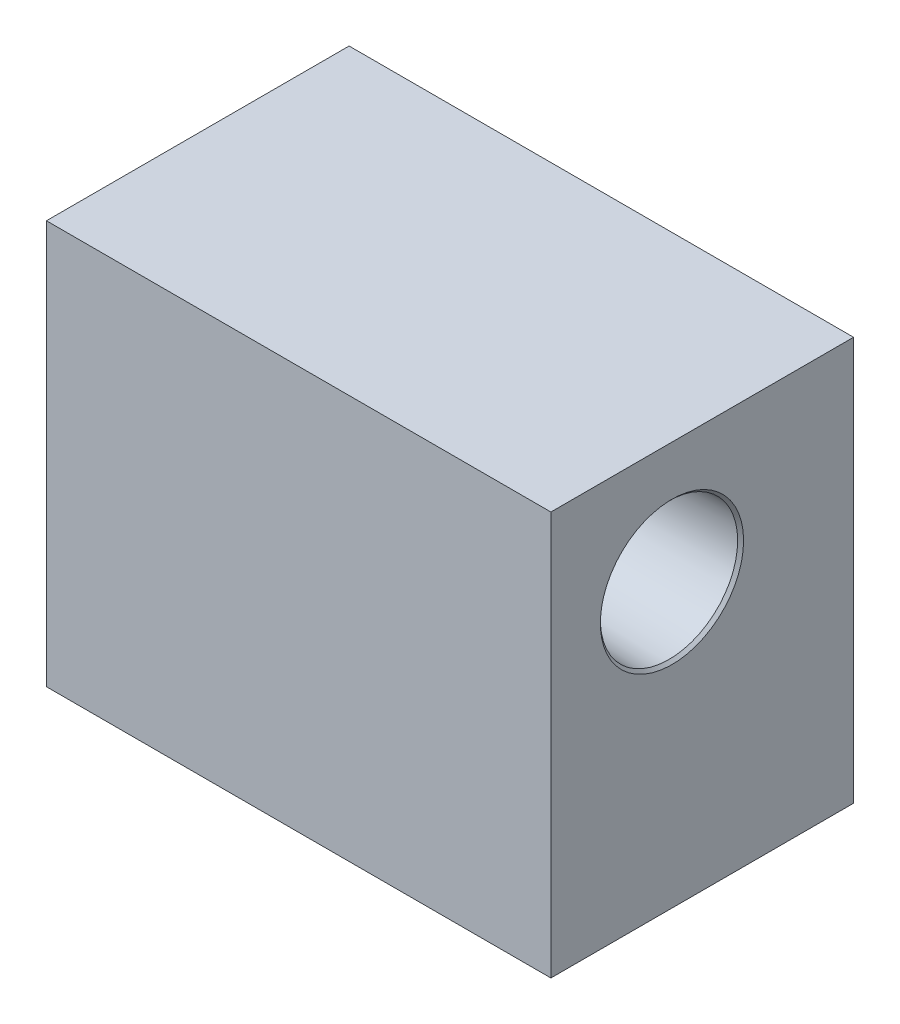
SolidWorks part; units mm, degrees
ref_plane "Front Plane" through (0, 0, 0) normal (0, 0, 1) x (1, 0, 0)
ref_plane "Top Plane" through (0, 0, 0) normal (0, 1, 0) x (1, 0, 0)
ref_plane "Right Plane" through (0, 0, 0) normal (1, 0, 0) x (0, 0, -1)
sketch "Sketch1" plane through (0, 0, 0) normal (0, 0, 1) x (1, 0, 0)
  line L1 (0, 0) -> (63.5, 0)
  line L2 (0, 0) -> (0, 50.8)
  line L3 (0, 50.8) -> (63.5, 50.8)
  line L4 (63.5, 0) -> (63.5, 50.8)
  dimension "D1" = 63.5
  dimension "D2" = 50.8
extrude "Boss-Extrude1" add sketch "Sketch1" along normal blind 38.1 contours L3 L4 L1 L2
hole_wizard "3/4 NPT Tapped Hole1" positions "Sketch3" profile "Sketch2" size "3/4" standard "ANSI Inch"
sketch "Sketch3" plane through (0, 0, 0) normal (0, -1, 0) x (-1, 0, 0)
  line L1 (0, -19.05) -> (-31.75, -19.05) construction
  line L2 (0, -38.1) -> (0, 0) construction
  line L4 (-31.75, -38.1) -> (-31.75, -19.05) construction
  line L5 (0, -38.1) -> (-63.5, -38.1) construction
  point P0 (-31.75, -19.05)
sketch "Sketch2" plane through (31.75, 0, 19.05) normal (1, 0, 0) x (0, 0, -1)
  line L0 (0, 0) -> (0, 45.0136)
  line L1 (11.5062, 38.1) -> (0, 45.0136)
  line L2 (-11.5062, 38.1) -> (0, 45.0136) construction
  line L3 (11.5062, 38.1) -> (11.5062, 13.97)
  line L4 (11.5062, 13.97) -> (12.9332, 13.97)
  line L5 (12.9332, 13.97) -> (13.3325, 0.635)
  line L6 (13.3325, 0.635) -> (13.9675, 0)
  line L7 (13.9675, 0) -> (0, 0)
  line L8 (0, -6.35) -> (0, 107.95) construction
  line L9 (-13.3325, 0.635) -> (-13.9675, 0) construction
  line L11 (-11.5062, 13.97) -> (-12.9332, 13.97) construction
  line L12 (-12.9332, 13.97) -> (-13.3325, 0.635) construction
  dimension "Tap Drill Dia." = 23.0124
  dimension "Tap Drill Depth" = 38.1
  dimension "Thread Dia." = 26.665
  dimension "Thread Angle" = 3.43
  dimension "Thread Depth" = 13.97
  dimension "C'Sink Dia." = 27.935
  dimension "C'Sink Angle" = 90
  dimension "Drill Angle" = 118
hole_wizard "3/8 NPT Tapped Hole1" positions "Sketch7" profile "Sketch6" size "3/8" standard "ANSI Inch"
sketch "Sketch7" plane through (63.5, 0, 0) normal (1, 0, 0) x (0, 0, -1)
  line L0 (-19.05, 50.8) -> (-19.05, 35.56)
  line L1 (-38.1, 50.8) -> (0, 50.8) construction
  point P0 (-22.86, 35.56)
  dimension "D1" = 15.24
  dimension "D2" = 3.81
sketch "Sketch6" plane through (63.5, 35.56, 22.86) normal (0, 1, 0) x (0, 0, -1)
  line L0 (0, 0) -> (0, 36.0386)
  line L1 (7.1374, 31.75) -> (0, 36.0386)
  line L2 (-7.1374, 31.75) -> (0, 36.0386) construction
  line L3 (7.1374, 31.75) -> (7.1374, 12.7)
  line L4 (7.1374, 12.7) -> (8.2744, 12.7)
  line L5 (8.2744, 12.7) -> (8.6435, 0.3735)
  line L6 (8.6435, 0.3735) -> (9.017, 0)
  line L7 (9.017, 0) -> (0, 0)
  line L8 (0, -6.35) -> (0, 107.95) construction
  line L9 (-8.6435, 0.3735) -> (-9.017, 0) construction
  line L11 (-7.1374, 12.7) -> (-8.2744, 12.7) construction
  line L12 (-8.2744, 12.7) -> (-8.6435, 0.3735) construction
  dimension "Tap Drill Dia." = 14.2748
  dimension "Tap Drill Depth" = 31.75
  dimension "Thread Dia." = 17.2869
  dimension "Thread Angle" = 3.43
  dimension "Thread Depth" = 12.7
  dimension "C'Sink Dia." = 18.034
  dimension "C'Sink Angle" = 90
  dimension "Drill Angle" = 118
ref_plane "Plane1" through (31.75, 0, 0) normal (1, 0, 0) x (0, 0, -1)
hole_wizard "3/8 NPT Tapped Hole2" positions "Sketch9" profile "Sketch8" size "3/8" standard "ANSI Inch"
sketch "Sketch9" plane through (0, 0, 0) normal (-1, 0, 0) x (0, 0, 1)
  line L0 (19.05, 50.8) -> (19.05, 35.56)
  line L1 (38.1, 50.8) -> (0, 50.8) construction
  point P0 (15.24, 35.56)
  dimension "D1" = 15.24
  dimension "D2" = 3.81
sketch "Sketch8" plane through (0, 35.56, 15.24) normal (0, 1, 0) x (0, 0, 1)
  line L0 (0, 0) -> (0, 36.0386)
  line L1 (7.1374, 31.75) -> (0, 36.0386)
  line L2 (-7.1374, 31.75) -> (0, 36.0386) construction
  line L3 (7.1374, 31.75) -> (7.1374, 12.7)
  line L4 (7.1374, 12.7) -> (8.2744, 12.7)
  line L5 (8.2744, 12.7) -> (8.6435, 0.3735)
  line L6 (8.6435, 0.3735) -> (9.017, 0)
  line L7 (9.017, 0) -> (0, 0)
  line L8 (0, -6.35) -> (0, 107.95) construction
  line L9 (-8.6435, 0.3735) -> (-9.017, 0) construction
  line L11 (-7.1374, 12.7) -> (-8.2744, 12.7) construction
  line L12 (-8.2744, 12.7) -> (-8.6435, 0.3735) construction
  dimension "Tap Drill Dia." = 14.2748
  dimension "Tap Drill Depth" = 31.75
  dimension "Thread Dia." = 17.2869
  dimension "Thread Angle" = 3.43
  dimension "Thread Depth" = 12.7
  dimension "C'Sink Dia." = 18.034
  dimension "C'Sink Angle" = 90
  dimension "Drill Angle" = 118
